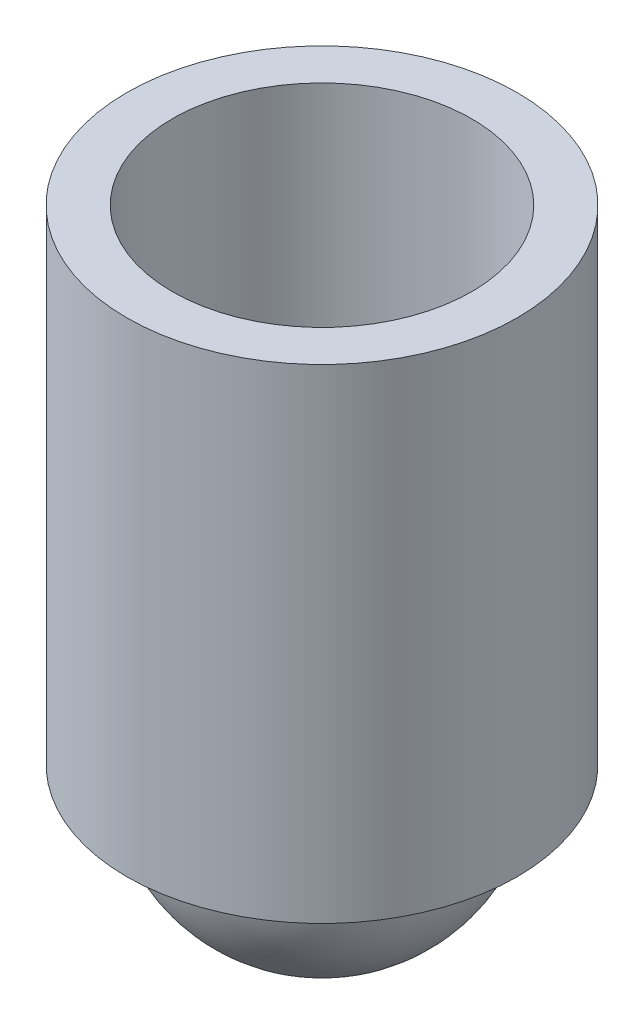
SolidWorks part; units mm, degrees
ref_plane "Front Plane" through (0, 0, 0) normal (0, 0, 1) x (1, 0, 0)
ref_plane "Top Plane" through (0, 0, 0) normal (0, 1, 0) x (1, 0, 0)
ref_plane "Right Plane" through (0, 0, 0) normal (1, 0, 0) x (0, 0, -1)
sketch "Sketch1" plane through (0, 0, 0) normal (0, 1, 0) x (1, 0, 0)
  circle A0 centre (0, 0) radius 81.915
  dimension "D1" = 163.83
extrude "Extrude1" add sketch "Sketch1" against normal blind 203.2
sketch "Sketch2" plane through (0, -203.2, 0) normal (0, -1, 0) x (1, 0, 0)
  circle A0 centre (0, 0) radius 63.5
  dimension "D1" = 127
extrude "Extrude2" add sketch "Sketch2" along normal blind 63.5
fillet "Fillet1" radius 63.5 1 edges at (0, -266.7, -63.5)
shell "Shell1" thickness 19.05
